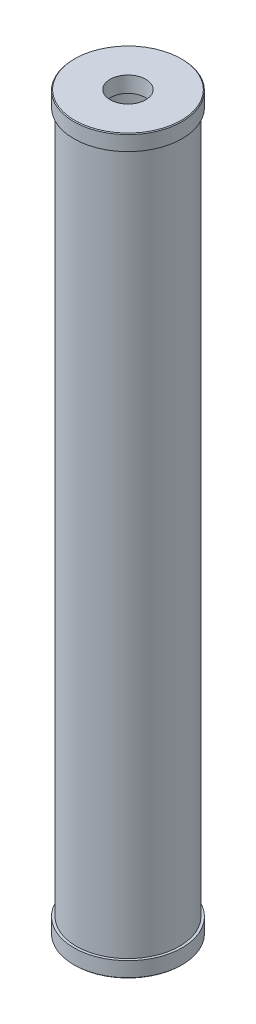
SolidWorks part; units mm, degrees
ref_plane "Front Plane" through (0, 0, 0) normal (0, 0, 1) x (1, 0, 0)
ref_plane "Top Plane" through (0, 0, 0) normal (0, 1, 0) x (1, 0, 0)
ref_plane "Right Plane" through (0, 0, 0) normal (1, 0, 0) x (0, 0, -1)
sketch "Sketch1" plane through (0, 0, 0) normal (0, 1, 0) x (1, 0, 0)
  circle A0 centre (0, 0) radius 84.201
  circle A1 centre (0, 0) radius 74.676
  dimension "D1" = 168.402
  dimension "D2" = 9.525
extrude "Boss-Extrude1" add sketch "Sketch1" along normal blind 1193.8
ref_plane "Plane1" through (0, 1193.8, 0) normal (0, 1, 0) x (1, 0, 0)
sketch "Sketch2" plane through (0, 0, 0) normal (0, 1, 0) x (1, 0, 0)
  circle A0 centre (0, 0) radius 88.265
  dimension "D1" = 176.53
extrude "Boss-Extrude2" add sketch "Sketch2" along normal blind 25.4
sketch "Sketch3" plane through (0, 1193.8, 0) normal (0, 1, 0) x (1, 0, 0)
  circle A0 centre (0, 0) radius 88.265
  dimension "D1" = 176.53
extrude "Boss-Extrude3" add sketch "Sketch3" against normal blind 25.4
hole_wizard "2 Rc Tapped Hole1" positions "Sketch5" profile "Sketch4" size "2" standard "BSI"
sketch "Sketch5" plane through (0, 1193.8, 0) normal (0, 1, 0) x (1, 0, 0)
  point P0 (0, 0)
sketch "Sketch4" plane through (0, 1193.8, 0) normal (1, 0, 0) x (0, 0, 1)
  line L0 (0, 0) -> (0, 53.5476)
  line L1 (27.4, 37.084) -> (0, 53.5476)
  line L2 (-27.4, 37.084) -> (0, 53.5476) construction
  line L3 (27.4, 37.084) -> (27.4, 25.654)
  line L4 (27.4, 25.654) -> (28.2652, 25.654)
  line L5 (28.2652, 25.654) -> (29.0661, 0)
  line L6 (-28.2652, 25.654) -> (-29.0661, 0) construction
  line L7 (29.0661, 0) -> (0, 0)
  line L8 (0, -6.35) -> (0, 107.95) construction
  line L11 (-27.4, 25.654) -> (-28.2652, 25.654) construction
  dimension "Tap Drill Dia." = 54.8
  dimension "Tap Drill Depth" = 37.084
  dimension "Thread Dia." = 58.1321
  dimension "Thread Angle" = 3.576
  dimension "Thread Depth" = 25.654
  dimension "Drill Angle" = 118
hole_wizard "2 Rc Tapped Hole2" positions "Sketch11" profile "Sketch10" size "2" standard "BSI"
sketch "Sketch11" plane through (0, 0, 0) normal (0, 1, 0) x (1, 0, 0)
  point P0 (0, 0)
sketch "Sketch10" plane through (0, 0, 0) normal (1, 0, 0) x (0, 0, -1)
  line L0 (0, 0) -> (0, 53.5476)
  line L1 (27.4, 37.084) -> (0, 53.5476)
  line L2 (-27.4, 37.084) -> (0, 53.5476) construction
  line L3 (27.4, 37.084) -> (27.4, 25.654)
  line L4 (27.4, 25.654) -> (28.2652, 25.654)
  line L5 (28.2652, 25.654) -> (29.0661, 0)
  line L6 (-28.2652, 25.654) -> (-29.0661, 0) construction
  line L7 (29.0661, 0) -> (0, 0)
  line L8 (0, -6.35) -> (0, 107.95) construction
  line L11 (-27.4, 25.654) -> (-28.2652, 25.654) construction
  dimension "Tap Drill Dia." = 54.8
  dimension "Tap Drill Depth" = 37.084
  dimension "Thread Dia." = 58.1321
  dimension "Thread Angle" = 3.576
  dimension "Thread Depth" = 25.654
  dimension "Drill Angle" = 118
chamfer "Chamfer1" distance 1.27 angle 45 2 edges at (0, 0, 88.265) (0, 1193.8, 88.265)
